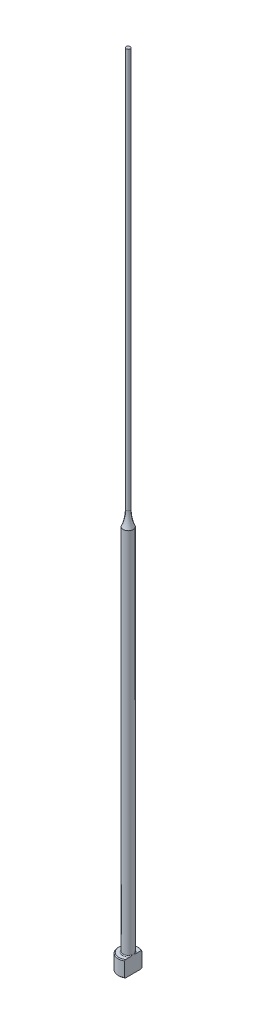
SolidWorks part; units mm, degrees
ref_plane "Front Plane" through (0, 0, 0) normal (0, 0, 1) x (1, 0, 0)
ref_plane "Top Plane" through (0, 0, 0) normal (0, 1, 0) x (1, 0, 0)
ref_plane "Right Plane" through (0, 0, 0) normal (1, 0, 0) x (0, 0, -1)
sketch "Sketch1" plane through (0, 0, 0) normal (0, 0, 1) x (1, 0, 0)
  line L0 (0, 259.9588) -> (0, -15.1925) construction
  line L1 (0, 0) -> (-2.5, 0)
  line L2 (-2.5, 0) -> (-2.5, 4)
  line L3 (-2.5, 4) -> (-1.25, 4)
  line L4 (-0.5, 100) -> (-0.5, 200)
  line L5 (-0.5, 200) -> (0, 200)
  line L6 (0, 200) -> (0, 0)
  line L7 (-1.25, 4) -> (-1.25, 96.2003)
  arc A0 (-1.25, 96.2003) -> (-0.5, 100) centre (-10.5, 100) ccw
  point P13 (-1.25, 0)
  dimension "D1" = 10
  dimension "L" = 200
  dimension "H" = 5
  dimension "T" = 4
  dimension "D" = 1
  dimension "B" = 2.5
  dimension "S" = 100
revolve "Revolve1" add sketch "Sketch1" angle 360 about L0
chamfer "Chamfer1" distance 0.2 angle 45 2 edges at (0, 4, 2.5) (0, 0, 2.5)
fillet "Fillet1" radius 0.2 1 edges at (0, 4, 1.25)
sketch "Sketch2" plane through (0, 0, 0) normal (0, 1, 0) x (1, 0, 0)
  line L0 (1.25, -2.1651) -> (1.25, 2.1651)
  circle A0 centre (0, 0) radius 2.5 construction
  arc A1 (1.25, -2.1651) -> (1.25, 2.1651) centre (0, 0) ccw
  circle A2 centre (0, 0) radius 1.25 construction
extrude "Keyed Head" cut sketch "Sketch2" along normal through all
